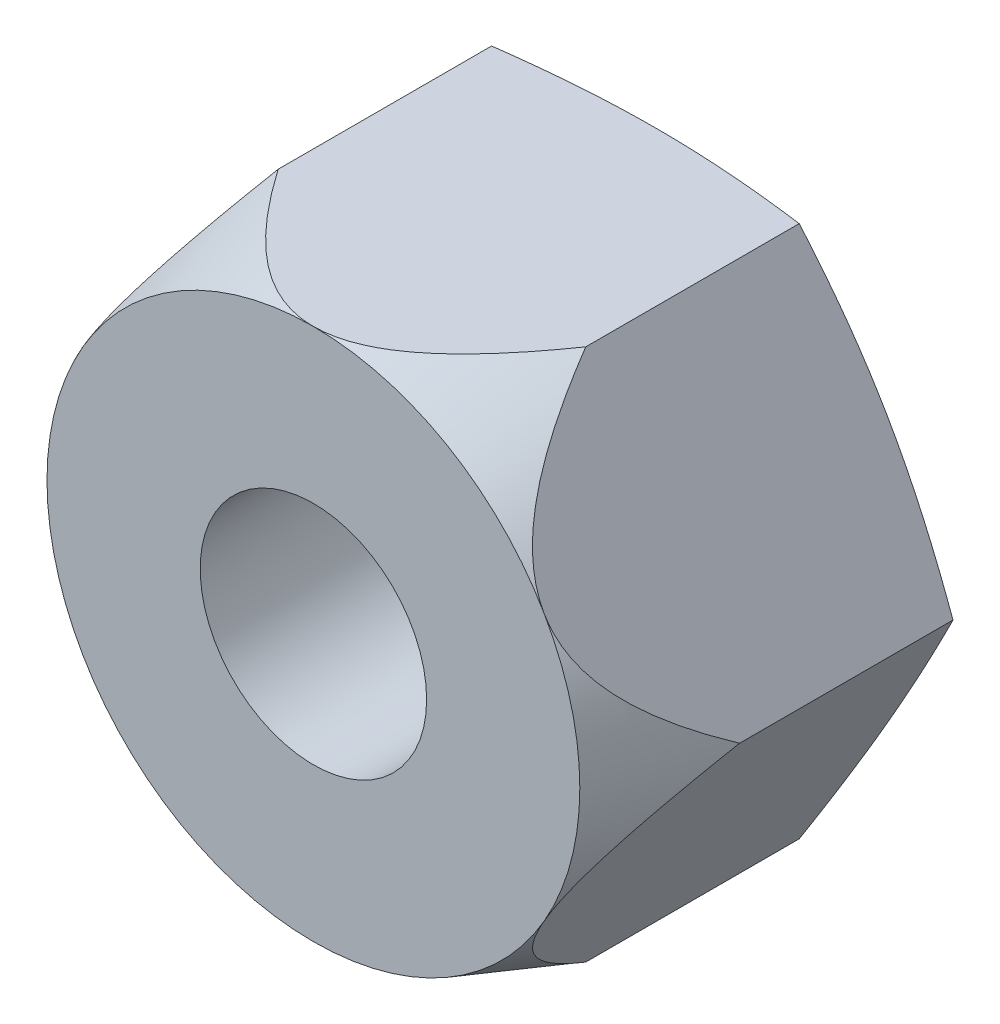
SolidWorks part; units mm, degrees
ref_plane "Front" through (0, 0, 0) normal (0, 0, 1) x (1, 0, 0)
ref_plane "Top" through (0, 0, 0) normal (0, 1, 0) x (1, 0, 0)
ref_plane "Right" through (0, 0, 0) normal (1, 0, 0) x (0, 0, -1)
other "Configuration Table"
sketch "Sketch1" plane through (0, 0, 0) normal (0, 0, 1) x (1, 0, 0)
  line L1 (2.3094, -4) -> (4.6188, 0)
  line L2 (4.6188, 0) -> (2.3094, 4)
  line L3 (2.3094, 4) -> (-2.3094, 4)
  line L4 (-2.3094, 4) -> (-4.6188, 0)
  line L5 (-4.6188, 0) -> (-2.3094, -4)
  line L6 (-2.3094, -4) -> (2.3094, -4)
  circle A0 centre (0, 0) radius 4 construction
extrude "BaseNut" add sketch "Sketch1" against normal blind 5.3
sketch "Sketch2" plane through (0.4812, 0, -5.1) normal (0, -1, 0) x (0, 0, -1)
  line L0 (-0.1158, 4.1376) -> (0.2, 4.1376)
  line L2 (0.2, 4.1376) -> (0.2, 2.9588)
  line L3 (-5.1, 1.8282) -> (-5.1, 4.1376) construction
  line L4 (0.2, 2.9588) -> (-0.1158, 4.1376)
  line L5 (-5.1, 4.1376) -> (-3.32, 4.1376)
  line L6 (-5.1, 4.1376) -> (-5.1, 3.5188)
  line L7 (0.2, 1.8282) -> (0.2, 4.1376) construction
  line L8 (-5.1, 3.5188) -> (-3.32, 4.1376)
  line L9 (-0.6371, -0.4812) -> (-5.5811, -0.4812) construction
  line L10 (0.2, 4.1376) -> (-5.1, 4.1376) construction
revolve "Double-Chamfer" cut sketch "Sketch2" angle 360 about L9
sketch "Sketch3" plane through (0, 0, 0) normal (0, 0, 1) x (1, 0, 0)
  circle A0 centre (0, 0) radius 1.7
extrude "Hole" cut sketch "Sketch3" against normal through all
chamfer "EndChamfer" distance 0.4857 angle 45 1 edges at (1.7, 0, -5.3)
sketch "Sketch4" plane through (0, 0, 0) normal (0, 1, 0) x (1, 0, 0)
  line L0 (0, 6.8088) -> (0, -0.7438) construction
  line L1 (1.4, 4.9643) -> (1.7, 4.9643)
  line L2 (1.7, 4.9643) -> (1.9598, 4.8143)
  line L3 (1.9598, 4.8143) -> (1.7, 4.6643)
  line L4 (1.7, 4.6643) -> (1.4, 4.6643)
  line L5 (1.4, 4.6643) -> (1.4, 4.9643)
  line L6 (-1.7, 4.8143) -> (1.7, 4.8143) construction
revolve "Cut-Revolve10" [suppressed] cut sketch "Sketch4" angle 360 about L0
pattern_linear "LPattern10" [suppressed] count 13 spacing 0.36 along (0, 0, 1)
equation "\"e@Sketch2\" = \"s@Sketch1\""
equation "\"D1@Sketch4\" = \"D1@Sketch3\""
equation "\"D2@Sketch4\" = (  \"D2@ThreadCosmetic1\" - \"D1@Sketch3\" )  / 2"
equation "\"D3@LPattern10\" = \"D2@Sketch4\" * 1.2"
equation "\"D1@LPattern10\" =  ( \"h@BaseNut\"  - \"D1@EndChamfer\" ) / \"D3@LPattern10\" "
equation "\"D1@EndChamfer\" = \"D1@Sketch3\" / 7"
